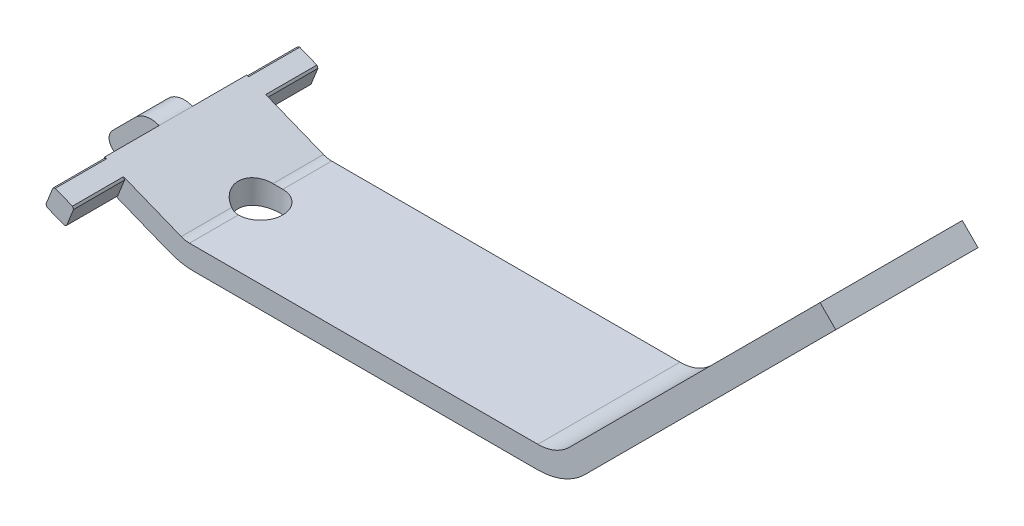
SolidWorks part; units mm, degrees
ref_plane "Plan de face" through (0, 0, 0) normal (0, 0, 1) x (1, 0, 0)
ref_plane "Plan de dessus" through (0, 0, 0) normal (0, 1, 0) x (1, 0, 0)
ref_plane "Plan de droite" through (0, 0, 0) normal (1, 0, 0) x (0, 0, -1)
sketch "Esquisse1" plane through (0, 0, 0) normal (0, 0, 1) x (1, 0, 0)
  line L0 (0, 0) -> (3.2496, -1.3) construction
  line L1 (3.2496, -1.3) -> (20.2496, -1.3) construction
  line L2 (3.3459, -0.8) -> (20.0425, -0.8) construction
  line L3 (-0.1857, -0.4642) -> (3.1533, -1.8)
  line L4 (3.1533, -1.8) -> (19.2141, -1.8)
  line L5 (20.2496, -1.3) -> (32.2704, 10.7208) construction
  line L6 (0.1857, 0.4642) -> (3.3459, -0.8)
  line L7 (3.3459, -0.8) -> (19.2141, -0.8)
  line L8 (21.3354, -0.9213) -> (32.624, 10.3673)
  line L9 (20.6283, -0.2142) -> (31.9169, 11.0744)
  line L10 (-0.1857, -0.4642) -> (3.1533, -1.8) construction
  line L11 (0.1857, 0.4642) -> (-0.2785, 0.6499)
  line L12 (-0.2785, 0.6499) -> (-0.6499, -0.2785)
  line L13 (-0.6499, -0.2785) -> (-0.1857, -0.4642)
  line L14 (0.5, 0.3385) -> (0.5, -0.7385) construction
  line L15 (20.0425, -0.8) -> (36.7254, 15.8829) construction
  line L16 (20.4567, -1.8) -> (37.4325, 15.1758) construction
  line L17 (20.2496, -1.3) -> (37.0789, 15.5293) construction
  line L18 (31.9169, 11.0744) -> (32.624, 10.3673)
  line L19 (20.6032, -1.6536) -> (32.624, 10.3673) construction
  line L20 (3.1533, -1.8) -> (20.4567, -1.8) construction
  line L21 (19.8961, -0.9464) -> (31.9169, 11.0744) construction
  arc A0 (0.1857, 0.4642) -> (-0.1857, -0.4642) centre (0, 0) ccw construction
  circle A1 centre (0, 0) radius 0.65 construction
  arc A2 (19.2141, -0.8) -> (20.6283, -0.2142) centre (19.2141, 1.2) ccw
  arc A3 (19.2141, -1.8) -> (21.3354, -0.9213) centre (19.2141, 1.2) ccw
  dimension "D4" = 0.5
  dimension "D7" = 1.3
  dimension "D11" = 2
  dimension "D12" = 3
  dimension "D1" = 3.5
  dimension "D2" = 17
  dimension "D3" = 135
  dimension "D9" = 1.8
  dimension "D10" = 17
  dimension "D5" = 0.5
  dimension "D6" = 0.5
  dimension "D8" = 0.5
extrude "Boss.-Extru.1" add sketch "Esquisse1" along normal mid plane 6.4
sketch "Esquisse2" plane through (0, 0, 0) normal (0, 0, 1) x (1, 0, 0)
  line L0 (-0.2785, 0.6499) -> (-0.6499, -0.2785) construction
  line L2 (-0.2785, 0.6499) -> (-0.6499, -0.2785)
  line L3 (0.6499, 0.2785) -> (0.2785, -0.6499)
  line L4 (-0.2785, 0.6499) -> (0.6499, 0.2785)
  line L5 (-0.6499, -0.2785) -> (0.2785, -0.6499)
  line L7 (-0.6499, -0.2785) -> (3.1533, -1.8) construction
extrude "Boss.-Extru.2" add sketch "Esquisse2" along normal mid plane 11
sketch "Esquisse3" plane through (0, 0, 5.5) normal (0, 0, 1) x (1, 0, 0)
  circle A0 centre (0, 0) radius 0.65
  dimension "D1" = 1.3
extrude "Enlèv. mat.-Extru.1" cut sketch "Esquisse3" against normal up to surface (2.3 mm away) flip side to cut
sketch "Esquisse4" plane through (0, 0, -5.5) normal (0, 0, -1) x (-1, 0, 0)
  circle A0 centre (0, 0) radius 0.65 construction
  circle A1 centre (0, 0) radius 0.65
extrude "Enlèv. mat.-Extru.2" cut sketch "Esquisse4" against normal up to surface (2.3 mm away) flip side to cut
sketch "Esquisse5" plane through (0, 0, 0) normal (0, 0, 1) x (1, 0, 0)
  line L0 (-0.2785, 0.6499) -> (-0.1999, 0.6185) construction
  line L1 (-0.31, 0.5713) -> (-0.2785, 0.6499) construction
  line L2 (-0.6499, -0.2785) -> (-0.6185, -0.1999) construction
  line L3 (-0.5713, -0.31) -> (-0.6499, -0.2785) construction
  line L4 (-0.2785, 0.6499) -> (-0.1999, 0.6185)
  line L5 (-0.31, 0.5713) -> (-0.2785, 0.6499)
  line L6 (-0.6499, -0.2785) -> (-0.6185, -0.1999)
  line L7 (-0.5713, -0.31) -> (-0.6499, -0.2785)
  arc A0 (-0.1999, 0.6185) -> (-0.31, 0.5713) centre (0, 0) ccw construction
  arc A1 (-0.6185, -0.1999) -> (-0.5713, -0.31) centre (0, 0) ccw construction
  arc A2 (-0.1999, 0.6185) -> (-0.31, 0.5713) centre (0, 0) ccw
  arc A3 (-0.6185, -0.1999) -> (-0.5713, -0.31) centre (0, 0) ccw
sketch "Esquisse6" plane through (0, 0, 0) normal (0, 0, 1) x (1, 0, 0)
  line L0 (-0.6499, -0.2785) -> (-1.675, -1.3036)
  line L2 (-2.3821, -0.5964) -> (-1.3571, 0.4286)
  line L3 (-0.4642, 0.1857) -> (1.5431, 0.1857) construction
  line L7 (-0.2785, 0.6499) -> (-0.6499, -0.2785) construction
  line L8 (-0.2785, 0.6499) -> (-0.6499, -0.2785)
  line L9 (-2.0285, -0.95) -> (-2.0878, -2.0756) construction
  arc A0 (-0.2785, 0.6499) -> (-1.3571, 0.4286) centre (-0.6499, -0.2785) ccw
  arc A1 (-2.3821, -0.5964) -> (-1.675, -1.3036) centre (-2.0285, -0.95) ccw
  point P1 (-1.9768, -1.9768)
  point P4 (-2.6839, -1.2697)
  dimension "D1" = 135
  dimension "D2" = 0.95
extrude "Boss.-Extru.3" add sketch "Esquisse6" along normal mid plane 1.5
fillet "Congé1" radius 3 1 edges at (3.1533, -1.8, 0)
fillet "Congé2" radius 1 1 edges at (3.3459, -0.8, 0)
sketch "Esquisse7" plane through (0, -0.8, 0) normal (0, 1, 0) x (1, 0, 0)
  line L0 (3.5385, 3.2) -> (3.5385, -3.2) construction
  circle A0 centre (3.5385, 0) radius 1
  dimension "D1" = 2
extrude "Enlèv. mat.-Extru.3" cut sketch "Esquisse7" against normal through all and the other way through all
